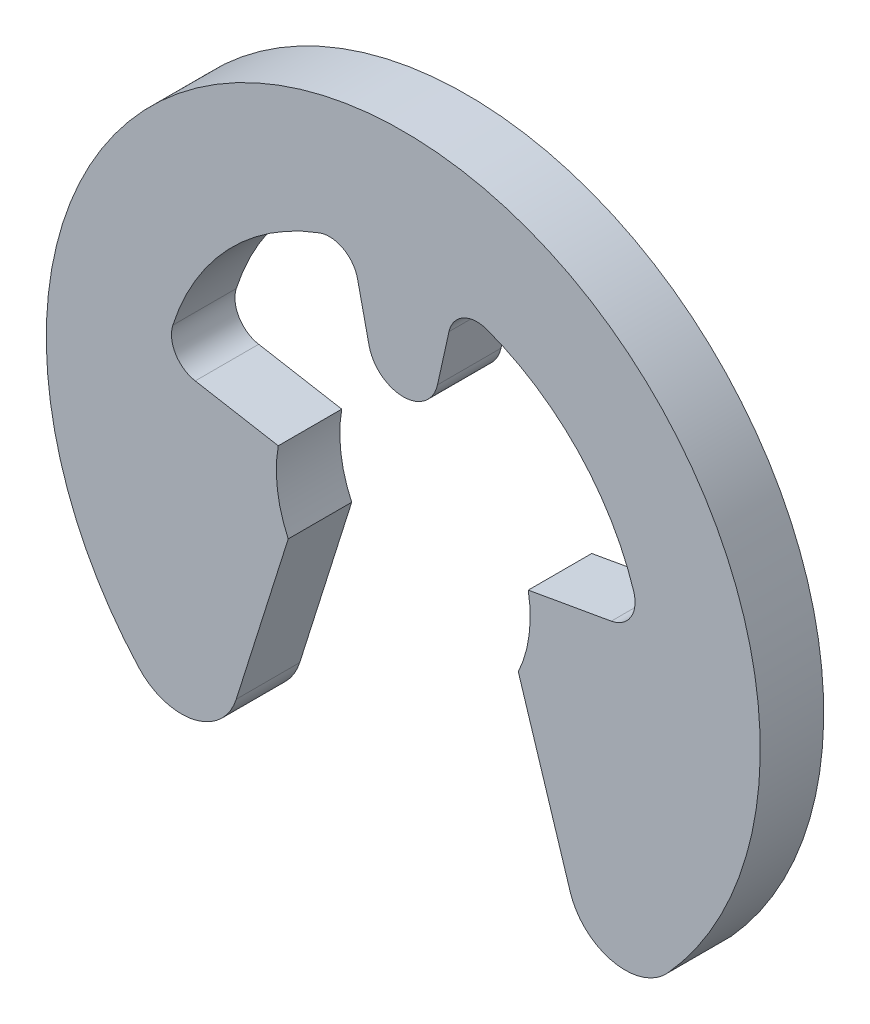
SolidWorks part; units mm, degrees
ref_plane "Plane1" through (0, 0, 0) normal (0, 0, 1) x (1, 0, 0)
ref_plane "Plane2" through (0, 0, 0) normal (0, 1, 0) x (1, 0, 0)
ref_plane "Plane3" through (0, 0, 0) normal (1, 0, 0) x (0, 0, -1)
other "Configuration Table"
sketch "BodySke" plane through (0, 0, 0) normal (0, 0, 1) x (1, 0, 0)
  line L0 (-0.7581, 0) -> (0.7581, 0) construction
  line L1 (0, 0) -> (0, 1.125) construction
  line L2 (0, 0) -> (0.1641, 0.7402) construction
  line L3 (0, 0) -> (1.0196, -0.4754) construction
  line L4 (0, 0) -> (-0.1641, 0.7402) construction
  line L5 (0, 0) -> (-1.0196, -0.4754) construction
  line L6 (0.3939, 0.0695) -> (0.6556, 0.1156)
  line L7 (-0.3939, 0.0695) -> (-0.6556, 0.1156)
  line L8 (0, 0) -> (1.1079, 0.1954) construction
  line L9 (0.3625, -0.169) -> (0.5263, -0.6884)
  line L10 (-0.3625, -0.169) -> (-0.5263, -0.6884)
  line L11 (0.1079, 0.4866) -> (0.1441, 0.65)
  line L12 (-0.1079, 0.4866) -> (-0.1441, 0.65)
  line L13 (0, 0) -> (-1.1079, 0.1954) construction
  circle A0 centre (0, 0) radius 0.4 construction
  arc A1 (0.7262, 0.2325) -> (0.2639, 0.7154) centre (0, 0) ccw
  arc A2 (0.8334, -0.7557) -> (-0.8334, -0.7557) centre (0, 0) ccw
  arc A3 (0.3625, -0.169) -> (0.3939, 0.0695) centre (0, 0) ccw
  arc A4 (-0.2639, 0.7154) -> (-0.7262, 0.2325) centre (0, 0) ccw
  arc A5 (0.6556, 0.1156) -> (0.7262, 0.2325) centre (0.6399, 0.2049) ccw
  arc A7 (0.2639, 0.7154) -> (0.1441, 0.65) centre (0.2326, 0.6303) ccw
  arc A8 (-0.3939, 0.0695) -> (-0.3625, -0.169) centre (0, 0) ccw
  arc A9 (-0.7262, 0.2325) -> (-0.6556, 0.1156) centre (-0.6399, 0.2049) ccw
  arc A10 (-0.1079, 0.4866) -> (0.1079, 0.4866) centre (0, 0.5105) ccw
  arc A11 (-0.1441, 0.65) -> (-0.2639, 0.7154) centre (-0.2326, 0.6303) ccw
  arc A12 (-0.8334, -0.7557) -> (-0.5263, -0.6884) centre (-0.6991, -0.6339) ccw
  arc A13 (0.5263, -0.6884) -> (0.8334, -0.7557) centre (0.6991, -0.6339) ccw
extrude "Body" add sketch "BodySke" against normal blind 0.2
equation "' \"Thickness@Body\" = 0.2"
equation "' \"GrooveDia@BodySke\" = 0.8"
equation "' \"OutsideDia@BodySke\" = 2.25"
equation "' \"Thickness@Body\" = 2.5"
equation "' \"GrooveDia@BodySke\" = 30"
equation "' \"OutsideDia@BodySke\" = 52.6"
equation "\"CavityDia@BodySke\" = (\"OutsideDia@BodySke\"  + \"GrooveDia@BodySke\") / 2 "
equation "\"CavityFilletRad@BodySke\" =  (\"CavityDia@BodySke\" - \"GrooveDia@BodySke\") / 2 * 0.25"
equation "\"TipRad@BodySke\" = (\"OutsideDia@BodySke\"  - \"GrooveDia@BodySke\") / 2 * 0.25"
